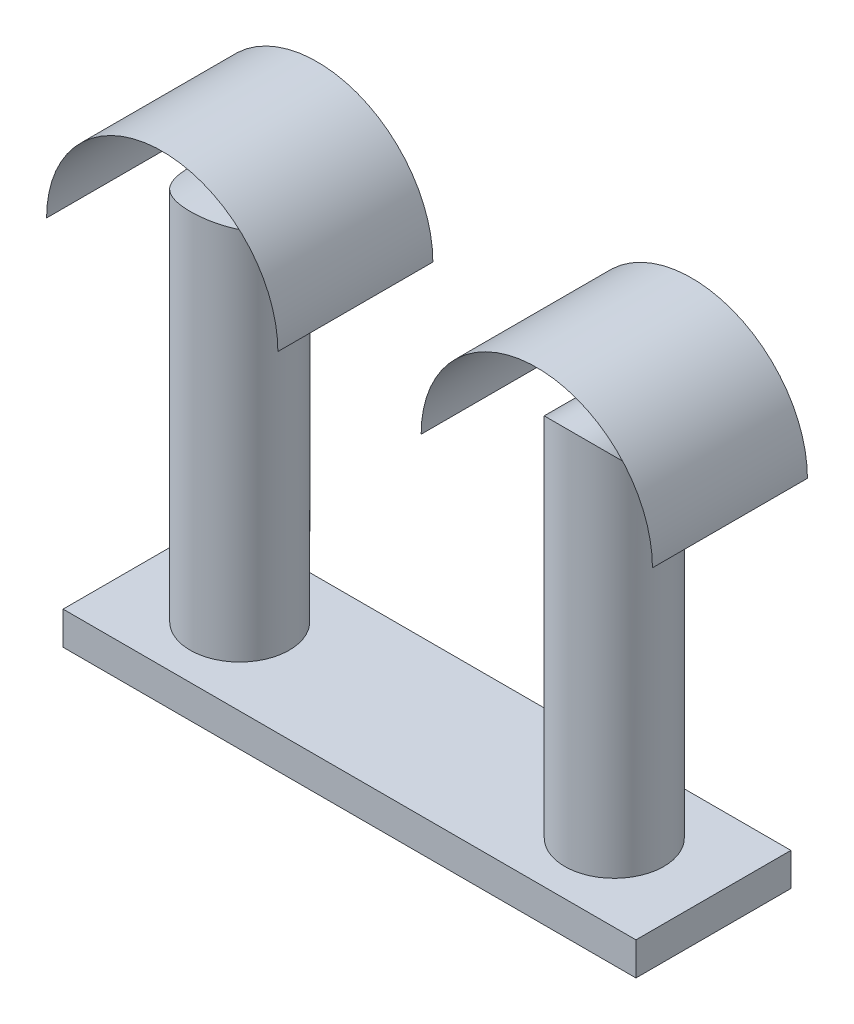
SolidWorks part; units mm, degrees
other "DetailItem1"
other "DetailItem2"
ref_plane "Front Plane" through (0, 0, 0) normal (0, 0, 1) x (1, 0, 0)
ref_plane "Top Plane" through (0, 0, 0) normal (0, 1, 0) x (1, 0, 0)
ref_plane "Right Plane" through (0, 0, 0) normal (1, 0, 0) x (0, 0, -1)
sketch "Sketch1" plane through (0, 0, 0) normal (0, 1, 0) x (1, 0, 0)
  line L1 (-86.6767, -23.4471) -> (86.6767, -23.4471)
  line L2 (-86.6767, -23.4471) -> (-86.6767, 23.4471)
  line L3 (-86.6767, 23.4471) -> (86.6767, 23.4471)
  line L4 (86.6767, -23.4471) -> (86.6767, 23.4471)
  line L5 (-86.6767, -23.4471) -> (86.6767, 23.4471) construction
  line L6 (-86.6767, 23.4471) -> (86.6767, -23.4471) construction
  point P0 (0, 0)
extrude "Extrude1" add sketch "Sketch1" along normal blind 10
sketch "Sketch2" plane through (0, 10, 0) normal (0, 1, 0) x (1, 0, 0)
  line L0 (-86.6767, 0) -> (86.6767, 0) construction
  line L1 (-86.6767, 23.4471) -> (-86.6767, -23.4471) construction
  line L2 (86.6767, -23.4471) -> (86.6767, 23.4471) construction
  circle A0 centre (-56.6767, 0) radius 15
  circle A1 centre (56.6767, 0) radius 15 construction
  dimension "D1" = 30
  dimension "D2" = 30
  dimension "D3" = 30
sketch "Sketch3" plane through (0, 0, 0) normal (0, 0, 1) x (1, 0, 0)
  line L0 (-86.6767, 10) -> (86.6767, 10) construction
  arc A0 (-91.6767, 110) -> (-21.6767, 110) centre (-56.6767, 110) cw
  dimension "D2" = 35
  dimension "D1" = 100
surface "Surface-Extrude2" sketch "Sketch3"
mirror "Mirror1" about plane through (0, 0, 0) normal (1, 0, 0)
extrude "Extrude2" add sketch "Sketch2" along normal offset from surface (115 mm away) 20
sketch "Sketch5" plane through (0, 10, 0) normal (0, 1, 0) x (1, 0, 0)
  circle A0 centre (56.6767, 0) radius 15 construction
  circle A1 centre (56.6767, 0) radius 15
extrude "Extrude3" add sketch "Sketch5" along normal offset from surface (115 mm away) 20
